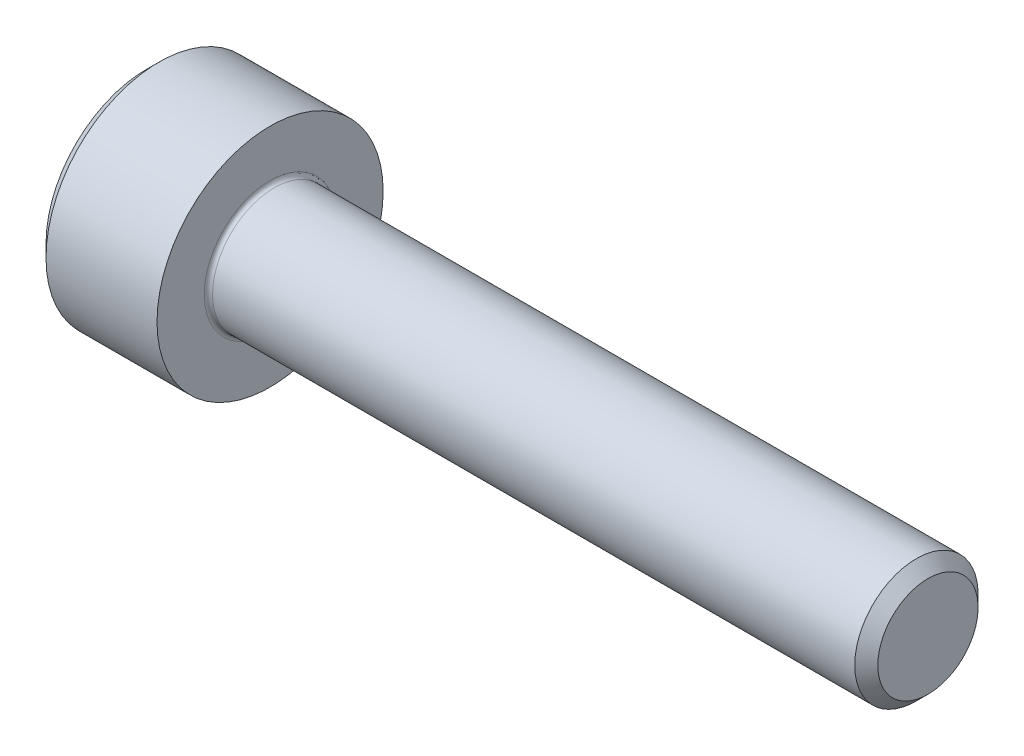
SolidWorks part; units mm, degrees
ref_plane "Plane1" through (0, 0, 0) normal (0, 0, 1) x (1, 0, 0)
ref_plane "Plane2" through (0, 0, 0) normal (0, 1, 0) x (1, 0, 0)
ref_plane "Plane3" through (0, 0, 0) normal (1, 0, 0) x (0, 0, -1)
revolve "Base-Revolve" add sketch "BodySke"
sketch "BodySke" plane through (0, 0, 0) normal (0, 0, 1) x (1, 0, 0)
  line L0 (0, 0) -> (0, 2.45)
  line L1 (0.3, 2.75) -> (3, 2.75)
  line L2 (3, 2.75) -> (3, 1.5)
  line L3 (3, 1.5) -> (18.7195, 1.5)
  line L4 (19, 1.2195) -> (19, 0)
  line L5 (19, 0) -> (0, 0)
  line L6 (-31.75, 0) -> (127, 0) construction
  line L7 (0, 2.45) -> (0.3, 2.75)
  line L8 (19, 1.2195) -> (18.7195, 1.5)
  line L9 (0, -2.45) -> (0.3, -2.75) construction
  line L10 (19, -1.2195) -> (18.7195, -1.5) construction
  line L11 (3.5, 9.525) -> (3.5, 3.175) construction
  line L12 (3, 9.525) -> (3, 3.175) construction
  line L13 (-31, 9.525) -> (-31, 3.175) construction
  dimension "Diameter" = 3
  dimension "Head_ht" = 3
  dimension "Length" = 16
  dimension "Body_ch_ang" = 45
  dimension "Head_dia" = 5.5
  dimension "Head_ch_ang" = 45
  dimension "Minor_dia" = 2.439
  dimension "Advance" = 0.5
  dimension "Thread_nom" = 16
  dimension "Thread_length" = 50
  dimension "Head_ch_ht" = 0.3
fillet "Fillet1" radius 0.1 1 edges at (3, 0, 1.5)
sketch "Sketch2" plane through (0, 0, 0) normal (0, 0, 1) x (1, 0, 0)
  line L0 (0, 1.28) -> (1.3, 1.28)
  line L1 (1.3, 1.28) -> (2.039, 0)
  line L2 (-31.75, 0) -> (127, 0) construction
  line L3 (2.039, 0) -> (0, 0)
  line L4 (0, 0) -> (0, 1.28)
  line L5 (0, 2.45) -> (0, -2.45) construction
  line L6 (0, 0) -> (47.625, 0) construction
  line L7 (3, -2.75) -> (3, 2.75) construction
  dimension "D1" = 1.28
  dimension "D2" = 60
  dimension "Wall_thickness" = 1.7
revolve "Hex-PreBroach" cut sketch "Sketch2" angle 360 about L6
sketch "Sketch3" plane through (0, 0, 0) normal (-1, 0, 0) x (0, 0.5, 0.866)
  line L0 (0.739, 1.28) -> (-0.739, 1.28)
  line L1 (-0.739, 1.28) -> (-1.478, 0)
  line L2 (0.739, 1.28) -> (1.478, 0)
  line L3 (0.739, -1.28) -> (1.478, 0)
  line L4 (0.739, -1.28) -> (-0.739, -1.28)
  line L5 (-0.739, -1.28) -> (-1.478, 0)
  dimension "D1" = 1.28
  dimension "D2" = 1.28
  dimension "Hex_size" = 2.56
extrude "Hex" cut sketch "Sketch3" against normal blind 1.3
sketch "Sketch4" plane through (0, 0, 0) normal (-1, 0, 0) x (0, 0, 1)
  line L0 (0, 0) -> (1.4605, 0)
  line L1 (0, 0) -> (6.1484, 3.5498) construction
  line L2 (0, 0) -> (0.7302, 1.2648)
  line L3 (1.2009, 0.3267) -> (1.3933, 0.4378)
  line L4 (0.8834, 0.8767) -> (1.0758, 0.9877)
  arc A0 (1.2009, 0.3267) -> (0.8834, 0.8767) centre (0, 0) ccw
  arc A1 (1.4605, 0) -> (1.3933, 0.4378) centre (0, 0) ccw
  arc A2 (0.7302, 1.2648) -> (1.0758, 0.9877) centre (0, 0) cw
  dimension "D1" = 30
  dimension "Spline_n_dim" = 2.4892
  dimension "Spline_m_dim" = 2.921
  dimension "D2" = 60
  dimension "D3" = 0.3175
  dimension "Spline_p_dim" = 0.635
extrude "Spline" cut sketch "Sketch4" against normal blind 1.3
pattern_circular "CirPattern1" count 6 every 60
sketch "Sketch5" plane through (0, 0, 0) normal (0, 0, 1) x (1, 0, 0)
  line L0 (-31.75, 0) -> (127, 0) construction
  line L1 (0, -0.739) -> (0, 0.739) construction
  line L2 (0, 2.45) -> (0, -2.45) construction
  circle A0 centre (1.2, 0) radius 0.475
  dimension "Drilled_hole_dia" = 0.95
  dimension "Drilled_hole_loc" = 1.2
extrude "Hole" cut sketch "Sketch5" against normal through all and the other way through all
pattern_circular "Drilled-4" count 2 every 60
pattern_circular "Drilled-6" count 3 every 60
sketch "ThdSchSke" plane through (0, 0, 0) normal (0, 0, 1) x (1, 0, 0)
  line L0 (3.5, -1.2195) -> (3.3036, -1.5)
  line L1 (3.5, -1.2195) -> (3.6964, -1.5)
  line L2 (3.6964, -1.5) -> (3.6964, -1.875)
  line L3 (-3.175, 0) -> (5.1513, 0) construction
  line L5 (3.6964, -1.875) -> (3.3036, -1.875)
  line L6 (3.3036, -1.875) -> (3.3036, -1.5)
  line L7 (0, 2.45) -> (0, -2.45) construction
  dimension "Thread_minor" = 2.439
  dimension "Diameter" = 3
  dimension "Start" = 3.5
  dimension "SideAngle" = 55
  dimension "VeeAngle" = 70
  dimension "Overcut" = 3.75
revolve "ThreadSchematic" cut sketch "ThdSchSke" angle 360 about L3
pattern_linear "ThdSchPat"
equation "\"D2@Sketch3\" = \"Hex_size@Sketch3\" / 2"
equation "\"D1@Sketch3\" = \"Hex_size@Sketch3\" / 2"
equation "\"D1@Sketch2\" = \"Hex_size@Sketch3\" / 2"
equation "\"D3@Sketch4\" = \"Spline_p_dim@Sketch4\" / 2"
equation "\"Thread_minor@ThreadCosmetic\"  =  \"Minor_dia@BodySke\""
equation "\"D2@CirPattern1\" = 360 / \"Num_teeth@CirPattern1\""
equation "\"Wall_thickness@Sketch2\" = \"Head_ht@BodySke\" - \"Key_eng@Hex\""
equation "\"Thread_length@ThreadCosmetic\" = ((sgn( (\"Length@BodySke\" - \"Advance@BodySke\" ) - \"Thread_nom@BodySke\" )-1)*( (\"Length@BodySke\" - \"Advance@BodySke\" ) - \"Thread_nom@BodySke\" ))/-2+ \"Thread_nom@BodySke\""
equation "\"Thread_minor@ThdSchSke\" = \"Minor_dia@BodySke\""
equation "\"Diameter@ThdSchSke\" = \"Diameter@BodySke\""
equation "\"Overcut@ThdSchSke\" = \"Diameter@BodySke\" * 1.25"
equation "\"Start@ThdSchSke\" = \"Head_ht@BodySke\" + \"Length@BodySke\" - \"Thread_length@ThreadCosmetic\"  '---Non-countersunk---"
equation "\"Num_threads@ThdSchPat\" = int( \"Thread_length@ThreadCosmetic\" / \"Advance@BodySke\" + 0.999 )  + 1"
equation "\"Advance@ThdSchPat\" = \"Thread_length@ThreadCosmetic\" /  (\"Num_threads@ThdSchPat\" - 1) 'relax it"
equation "\"Num_threads@ThdSchPat\" = \"Num_threads@ThdSchPat\" - sgn( \"Num_threads@ThdSchPat\" - 1) '---chamfered tips only---"
